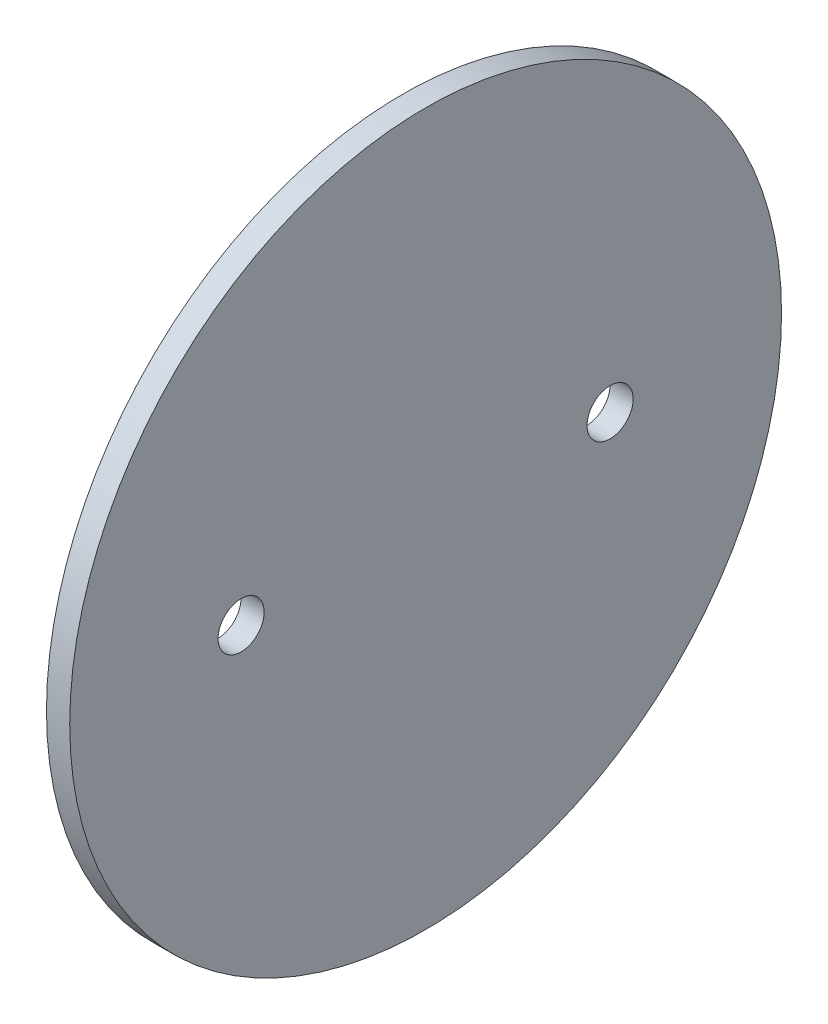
SolidWorks part; units mm, degrees
ref_plane "Front" through (0, 0, 0) normal (0, 0, 1) x (1, 0, 0)
ref_plane "Top" through (0, 0, 0) normal (0, 1, 0) x (1, 0, 0)
ref_plane "Right" through (0, 0, 0) normal (1, 0, 0) x (0, 0, -1)
sketch "Sketch1" plane through (0, 0, 0) normal (1, 0, 0) x (0, 0, -1)
  line L0 (-12.7, 0) -> (12.7, 0) construction
  circle A0 centre (0, 0) radius 24.5
  circle A1 centre (12.7, 0) radius 1.5875
  circle A2 centre (-12.7, 0) radius 1.5875
  dimension "D1" = 49
  dimension "D3" = 3.175
  dimension "D2" = 25.4
extrude "Extrude1" add sketch "Sketch1" along normal mid plane 1.6002
